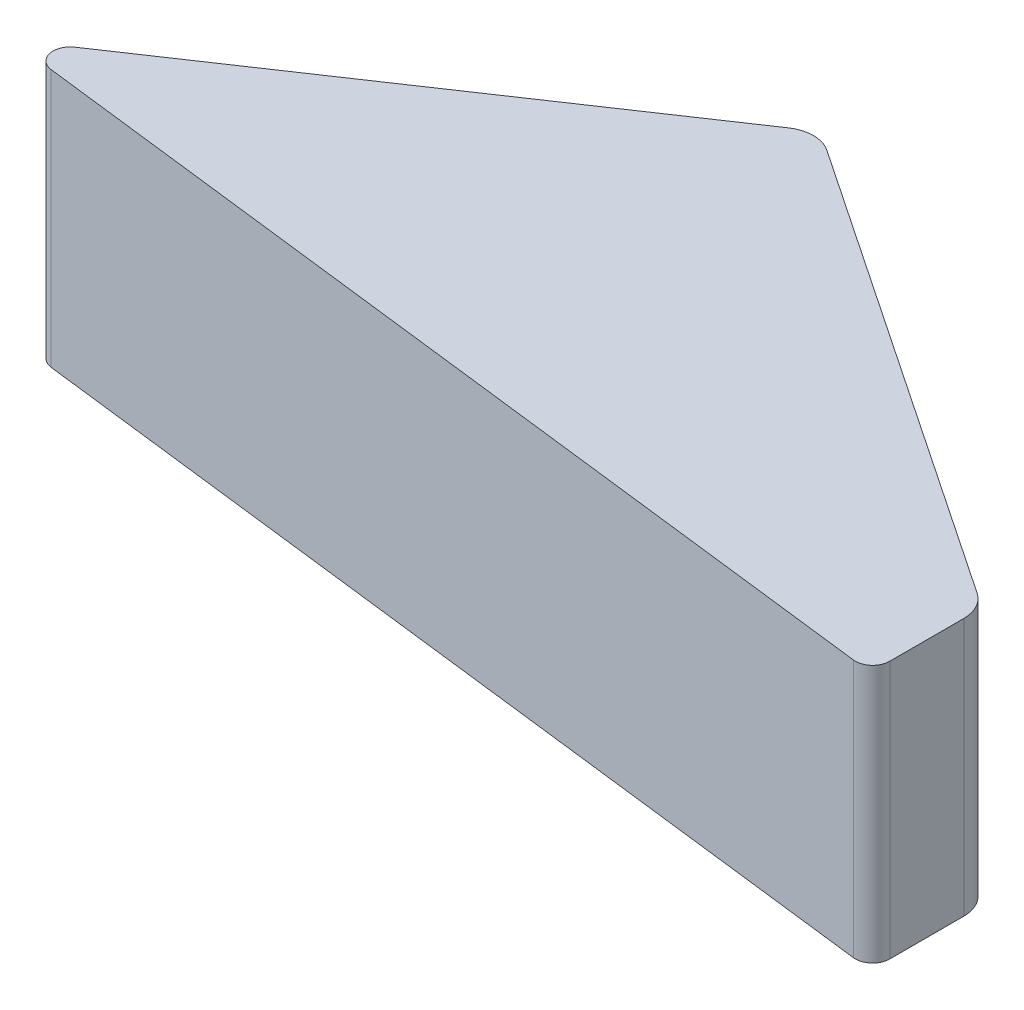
SolidWorks part; units mm, degrees
ref_plane "Спереди" through (0, 0, 0) normal (0, 0, 1) x (1, 0, 0)
ref_plane "Сверху" through (0, 0, 0) normal (0, 1, 0) x (1, 0, 0)
ref_plane "Справа" through (0, 0, 0) normal (1, 0, 0) x (0, 0, -1)
sketch "Эскиз1" plane through (0, 0, 0) normal (0, 1, 0) x (1, 0, 0)
  line L4 (27.884, 18.3881) -> (3.0683, 1.7016)
  line L5 (3.5064, -0.121) -> (56.5802, -6.5265)
  line L6 (57.7, -5.5337) -> (57.7, -1.2251)
  line L7 (30.116, 18.3881) -> (56.816, 0.4346)
  arc A0 (56.5802, -6.5265) -> (57.7, -5.5337) centre (56.7, -5.5337) ccw
  arc A1 (3.0683, 1.7016) -> (3.5064, -0.121) centre (3.6263, 0.8718) ccw
  arc A2 (57.7, -1.2251) -> (56.816, 0.4346) centre (55.7, -1.2251) ccw
  arc A3 (27.884, 18.3881) -> (30.116, 18.3881) centre (29, 16.7284) cw
  dimension "D1" = 1
  dimension "D2" = 2
extrude "Бобышка-Вытянуть1" add sketch "Эскиз1" along normal blind 15
